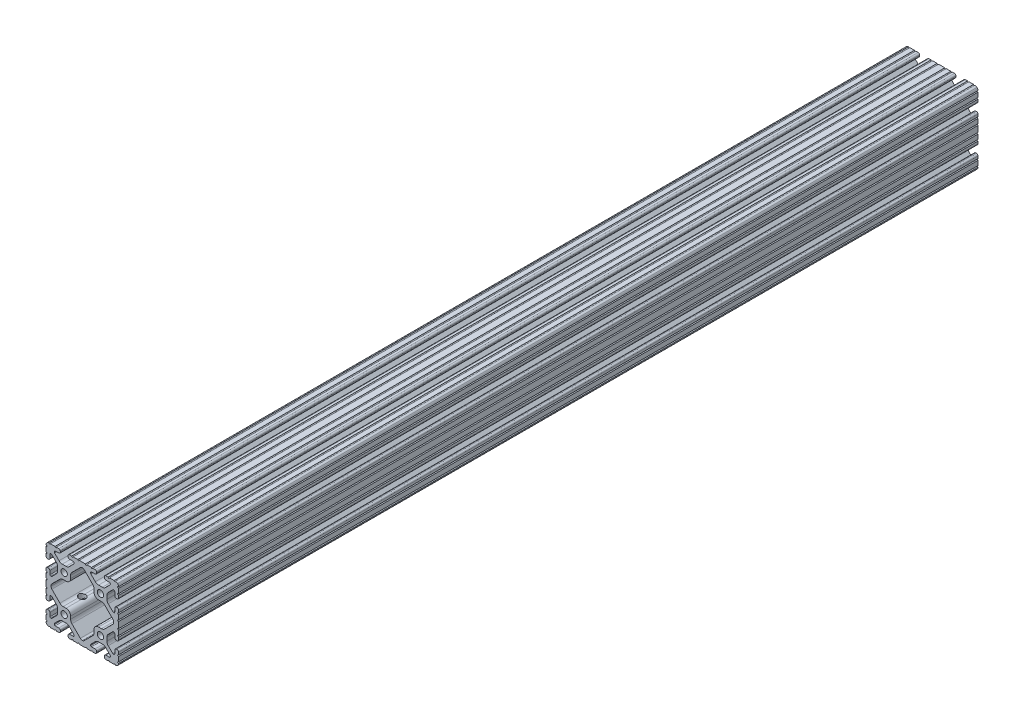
SolidWorks part; units mm, degrees
ref_plane "Front" through (0, 0, 0) normal (0, 0, 1) x (1, 0, 0)
ref_plane "Top" through (0, 0, 0) normal (0, 1, 0) x (1, 0, 0)
ref_plane "Right" through (0, 0, 0) normal (1, 0, 0) x (0, 0, -1)
sketch "Sketch1" plane through (0, 0, 0) normal (0, 0, 1) x (1, 0, 0)
  line L2 (242.4136, 86.674) -> (242.4136, 89.5766)
  line L3 (253.5953, 95.7176) -> (262.0221, 104.1444)
  line L4 (262.0221, 109.0956) -> (253.5953, 117.5224)
  line L5 (250.2367, 118.9136) -> (247.1634, 118.9136)
  line L6 (242.4136, 123.6634) -> (242.4136, 126.566)
  line L7 (241.0224, 129.9246) -> (232.1715, 138.7755)
  line L8 (228.0685, 138.7755) -> (219.2176, 129.9246)
  line L9 (217.8264, 126.566) -> (217.8264, 123.6634)
  line L10 (213.0766, 118.9136) -> (210.0033, 118.9136)
  line L11 (206.6447, 117.5224) -> (198.2179, 109.0956)
  line L12 (198.2179, 104.1444) -> (206.6447, 95.7176)
  line L13 (210.0033, 94.3264) -> (213.0766, 94.3264)
  line L14 (217.8264, 89.5766) -> (217.8264, 86.674)
  line L15 (219.2176, 83.3154) -> (228.0685, 74.4645)
  line L16 (232.1715, 74.4645) -> (241.0224, 83.3154)
  line L17 (247.1634, 94.3264) -> (250.2367, 94.3264)
  line L18 (225.3427, 144.72) -> (220.5147, 144.72)
  line L19 (218.9911, 144.72) -> (216.7088, 144.72)
  line L20 (215.134, 143.1452) -> (215.134, 142.2308)
  line L21 (216.7088, 140.656) -> (220.468, 140.656)
  line L22 (221.357, 139.767) -> (221.357, 139.1135)
  line L23 (221.0966, 138.4849) -> (216.4293, 133.8176)
  line L24 (213.0707, 132.4264) -> (209.0693, 132.4264)
  line L25 (205.7107, 133.8176) -> (201.0198, 138.5085)
  line L26 (200.783, 139.3407) -> (200.783, 139.767)
  line L27 (201.672, 140.656) -> (205.4312, 140.656)
  line L28 (207.006, 142.2308) -> (207.006, 143.1452)
  line L29 (205.4312, 144.72) -> (203.0428, 144.72)
  line L30 (201.5189, 144.72) -> (196.6912, 144.72)
  line L31 (192.02, 139.993) -> (192.02, 135.1653)
  line L32 (192.02, 133.6438) -> (192.02, 131.2502)
  line L33 (193.5948, 129.6754) -> (194.5092, 129.6754)
  line L34 (196.084, 131.2502) -> (196.084, 135.068)
  line L35 (196.973, 135.957) -> (197.4557, 135.957)
  line L36 (198.0843, 135.6966) -> (202.9224, 130.8585)
  line L37 (204.3136, 127.4999) -> (204.3136, 123.8401)
  line L38 (202.9224, 120.4815) -> (198.1711, 115.7301)
  line L39 (197.3331, 115.383) -> (197.0597, 115.383)
  line L40 (196.084, 116.3587) -> (196.084, 120.0898)
  line L41 (194.5092, 121.6646) -> (193.5948, 121.6646)
  line L42 (192.02, 120.0898) -> (192.02, 117.695)
  line L43 (192.02, 116.172) -> (192.02, 111.3438)
  line L44 (192.02, 109.8207) -> (192.02, 103.4193)
  line L45 (192.02, 101.8962) -> (192.02, 97.068)
  line L46 (192.02, 95.545) -> (192.02, 93.1502)
  line L47 (193.5948, 91.5754) -> (194.5092, 91.5754)
  line L48 (196.084, 93.1502) -> (196.084, 96.8813)
  line L49 (197.0597, 97.857) -> (197.3331, 97.857)
  line L50 (198.1711, 97.5099) -> (202.9224, 92.7585)
  line L51 (204.3136, 89.3999) -> (204.3136, 85.7401)
  line L52 (202.9224, 82.3815) -> (198.0843, 77.5434)
  line L53 (197.4557, 77.283) -> (196.973, 77.283)
  line L54 (196.084, 78.172) -> (196.084, 81.9898)
  line L55 (194.5092, 83.5646) -> (193.5948, 83.5646)
  line L56 (192.02, 81.9898) -> (192.02, 79.5962)
  line L57 (192.02, 78.0747) -> (192.02, 73.247)
  line L58 (196.6912, 68.52) -> (201.5189, 68.52)
  line L59 (203.0428, 68.52) -> (205.4312, 68.52)
  line L60 (207.006, 70.0948) -> (207.006, 71.0092)
  line L61 (205.4312, 72.584) -> (201.672, 72.584)
  line L62 (200.783, 73.473) -> (200.783, 73.8993)
  line L63 (201.0198, 74.7315) -> (205.7107, 79.4224)
  line L64 (209.0693, 80.8136) -> (213.0707, 80.8136)
  line L65 (216.4293, 79.4224) -> (221.0966, 74.7551)
  line L66 (221.357, 74.1265) -> (221.357, 73.473)
  line L67 (220.468, 72.584) -> (216.7088, 72.584)
  line L68 (215.134, 71.0092) -> (215.134, 70.0948)
  line L69 (216.7088, 68.52) -> (218.9911, 68.52)
  line L70 (220.5147, 68.52) -> (225.3427, 68.52)
  line L71 (226.8663, 68.52) -> (233.3737, 68.52)
  line L72 (234.8973, 68.52) -> (239.7253, 68.52)
  line L73 (241.2489, 68.52) -> (243.5312, 68.52)
  line L74 (245.106, 70.0948) -> (245.106, 71.0092)
  line L75 (243.5312, 72.584) -> (239.772, 72.584)
  line L76 (238.883, 73.473) -> (238.883, 74.1265)
  line L77 (239.1434, 74.7551) -> (243.8107, 79.4224)
  line L78 (247.1693, 80.8136) -> (251.1707, 80.8136)
  line L79 (254.5293, 79.4224) -> (259.2202, 74.7315)
  line L80 (259.457, 73.8993) -> (259.457, 73.473)
  line L81 (258.568, 72.584) -> (254.8088, 72.584)
  line L82 (253.234, 71.0092) -> (253.234, 70.0948)
  line L83 (254.8088, 68.52) -> (257.1972, 68.52)
  line L84 (258.7211, 68.52) -> (263.5488, 68.52)
  line L85 (268.22, 73.247) -> (268.22, 78.0747)
  line L86 (268.22, 79.5962) -> (268.22, 81.9898)
  line L87 (266.6452, 83.5646) -> (265.7308, 83.5646)
  line L88 (264.156, 81.9898) -> (264.156, 78.172)
  line L89 (263.267, 77.283) -> (262.7843, 77.283)
  line L90 (262.1557, 77.5434) -> (257.3176, 82.3815)
  line L91 (255.9264, 85.7401) -> (255.9264, 89.3999)
  line L92 (257.3176, 92.7585) -> (262.0689, 97.5099)
  line L93 (262.9069, 97.857) -> (263.1803, 97.857)
  line L94 (264.156, 96.8813) -> (264.156, 93.1502)
  line L95 (265.7308, 91.5754) -> (266.6452, 91.5754)
  line L96 (268.22, 93.1502) -> (268.22, 95.545)
  line L97 (268.22, 97.068) -> (268.22, 101.8962)
  line L98 (268.22, 103.4193) -> (268.22, 109.8207)
  line L99 (268.22, 111.3438) -> (268.22, 116.172)
  line L100 (268.22, 117.695) -> (268.22, 120.0898)
  line L101 (266.6452, 121.6646) -> (265.7308, 121.6646)
  line L102 (264.156, 120.0898) -> (264.156, 116.3587)
  line L103 (263.1803, 115.383) -> (262.9069, 115.383)
  line L104 (262.0689, 115.7301) -> (257.3176, 120.4815)
  line L105 (255.9264, 123.8401) -> (255.9264, 127.4999)
  line L106 (257.3176, 130.8585) -> (262.1557, 135.6966)
  line L107 (262.7843, 135.957) -> (263.267, 135.957)
  line L108 (264.156, 135.068) -> (264.156, 131.2502)
  line L109 (265.7308, 129.6754) -> (266.6452, 129.6754)
  line L110 (268.22, 131.2502) -> (268.22, 133.6438)
  line L111 (268.22, 135.1653) -> (268.22, 139.993)
  line L112 (263.5488, 144.72) -> (258.7211, 144.72)
  line L113 (257.1972, 144.72) -> (254.8088, 144.72)
  line L114 (253.234, 143.1452) -> (253.234, 142.2308)
  line L115 (254.8088, 140.656) -> (258.568, 140.656)
  line L116 (259.457, 139.767) -> (259.457, 139.3407)
  line L117 (259.2202, 138.5085) -> (254.5293, 133.8176)
  line L118 (251.1707, 132.4264) -> (247.1693, 132.4264)
  line L119 (243.8107, 133.8176) -> (239.1434, 138.4849)
  line L120 (238.883, 139.1135) -> (238.883, 139.767)
  line L121 (239.772, 140.656) -> (243.5312, 140.656)
  line L122 (245.106, 142.2308) -> (245.106, 143.1452)
  line L123 (243.5312, 144.72) -> (241.2489, 144.72)
  line L124 (239.7253, 144.72) -> (234.8973, 144.72)
  line L125 (233.3737, 144.72) -> (226.8663, 144.72)
  arc A0 (241.0224, 83.3154) -> (242.4136, 86.674) centre (237.6638, 86.674) ccw
  arc A1 (247.1634, 94.3264) -> (242.4136, 89.5766) centre (247.1634, 89.5766) ccw
  arc A2 (250.2367, 94.3264) -> (253.5953, 95.7176) centre (250.2367, 99.0762) ccw
  arc A3 (262.0221, 104.1444) -> (262.8487, 106.62) centre (259.9567, 106.2098) ccw
  arc A4 (262.8487, 106.62) -> (262.0221, 109.0956) centre (259.9567, 107.0302) ccw
  arc A5 (253.5953, 117.5224) -> (250.2367, 118.9136) centre (250.2367, 114.1638) ccw
  arc A6 (242.4136, 123.6634) -> (247.1634, 118.9136) centre (247.1634, 123.6634) ccw
  arc A7 (242.4136, 126.566) -> (241.0224, 129.9246) centre (237.6638, 126.566) ccw
  arc A8 (232.1715, 138.7755) -> (230.12, 139.631) centre (230.1061, 136.71) ccw
  arc A9 (230.12, 139.631) -> (228.0685, 138.7755) centre (230.1339, 136.71) ccw
  arc A10 (219.2176, 129.9246) -> (217.8264, 126.566) centre (222.5762, 126.566) ccw
  arc A11 (213.0766, 118.9136) -> (217.8264, 123.6634) centre (213.0766, 123.6634) ccw
  arc A12 (210.0033, 118.9136) -> (206.6447, 117.5224) centre (210.0033, 114.1638) ccw
  arc A13 (198.2179, 109.0956) -> (197.3913, 106.62) centre (200.2833, 107.0302) ccw
  arc A14 (197.3913, 106.62) -> (198.2179, 104.1444) centre (200.2833, 106.2098) ccw
  arc A15 (206.6447, 95.7176) -> (210.0033, 94.3264) centre (210.0033, 99.0762) ccw
  arc A16 (217.8264, 89.5766) -> (213.0766, 94.3264) centre (213.0766, 89.5766) ccw
  arc A17 (217.8264, 86.674) -> (219.2176, 83.3154) centre (222.5762, 86.674) ccw
  arc A18 (228.0685, 74.4645) -> (230.12, 73.609) centre (230.1339, 76.53) ccw
  arc A19 (230.12, 73.609) -> (232.1715, 74.4645) centre (230.1061, 76.53) ccw
  circle A20 centre (211.07, 125.67) radius 3.3274
  circle A21 centre (211.07, 87.57) radius 3.3274
  circle A22 centre (249.17, 87.57) radius 3.3274
  circle A23 centre (249.17, 125.67) radius 3.3274
  arc A24 (218.9911, 144.72) -> (220.5147, 144.72) centre (219.7529, 144.7024) ccw
  arc A25 (216.7088, 144.72) -> (215.134, 143.1452) centre (216.7088, 143.1452) ccw
  arc A26 (215.134, 142.2308) -> (216.7088, 140.656) centre (216.7088, 142.2308) ccw
  arc A27 (221.357, 139.767) -> (220.468, 140.656) centre (220.468, 139.767) ccw
  arc A28 (221.0966, 138.4849) -> (221.357, 139.1135) centre (220.468, 139.1135) ccw
  arc A29 (213.0707, 132.4264) -> (216.4293, 133.8176) centre (213.0707, 137.1762) ccw
  arc A30 (205.7107, 133.8176) -> (209.0693, 132.4264) centre (209.0693, 137.1762) ccw
  arc A31 (200.783, 139.3407) -> (201.0198, 138.5085) centre (201.6484, 139.1372) ccw
  arc A32 (201.672, 140.656) -> (200.783, 139.767) centre (201.672, 139.767) ccw
  arc A33 (205.4312, 140.656) -> (207.006, 142.2308) centre (205.4312, 142.2308) ccw
  arc A34 (207.006, 143.1452) -> (205.4312, 144.72) centre (205.4312, 143.1452) ccw
  arc A35 (201.5189, 144.72) -> (203.0428, 144.72) centre (202.2808, 144.7024) ccw
  arc A36 (195.1673, 144.72) -> (196.6912, 144.72) centre (195.9293, 144.7024) ccw
  arc A37 (195.1673, 144.72) -> (193.0339, 143.8026) centre (195.2679, 141.5466) ccw
  arc A38 (193.0339, 143.8026) -> (192.02, 141.4655) centre (195.195, 141.4766) ccw
  arc A39 (192.02, 139.993) -> (192.02, 141.4655) centre (192.2165, 140.7292) ccw
  arc A40 (192.02, 133.6438) -> (192.02, 135.1653) centre (192.2165, 134.4045) ccw
  arc A41 (192.02, 131.2502) -> (193.5948, 129.6754) centre (193.5948, 131.2502) ccw
  arc A42 (194.5092, 129.6754) -> (196.084, 131.2502) centre (194.5092, 131.2502) ccw
  arc A43 (196.973, 135.957) -> (196.084, 135.068) centre (196.973, 135.068) ccw
  arc A44 (198.0843, 135.6966) -> (197.4557, 135.957) centre (197.4557, 135.068) ccw
  arc A45 (204.3136, 127.4999) -> (202.9224, 130.8585) centre (199.5638, 127.4999) ccw
  arc A46 (202.9224, 120.4815) -> (204.3136, 123.8401) centre (199.5638, 123.8401) ccw
  arc A47 (197.3331, 115.383) -> (198.1711, 115.7301) centre (197.3331, 116.5681) ccw
  arc A48 (196.084, 116.3587) -> (197.0597, 115.383) centre (197.0597, 116.3587) ccw
  arc A49 (196.084, 120.0898) -> (194.5092, 121.6646) centre (194.5092, 120.0898) ccw
  arc A50 (193.5948, 121.6646) -> (192.02, 120.0898) centre (193.5948, 120.0898) ccw
  arc A51 (192.02, 116.172) -> (192.02, 117.695) centre (192.2165, 116.9335) ccw
  arc A52 (192.02, 109.8207) -> (192.02, 111.3438) centre (192.2165, 110.5822) ccw
  arc A53 (192.02, 101.8962) -> (192.02, 103.4193) centre (192.2165, 102.6578) ccw
  arc A54 (192.02, 95.545) -> (192.02, 97.068) centre (192.2165, 96.3065) ccw
  arc A55 (192.02, 93.1502) -> (193.5948, 91.5754) centre (193.5948, 93.1502) ccw
  arc A56 (194.5092, 91.5754) -> (196.084, 93.1502) centre (194.5092, 93.1502) ccw
  arc A57 (197.0597, 97.857) -> (196.084, 96.8813) centre (197.0597, 96.8813) ccw
  arc A58 (198.1711, 97.5099) -> (197.3331, 97.857) centre (197.3331, 96.6719) ccw
  arc A59 (204.3136, 89.3999) -> (202.9224, 92.7585) centre (199.5638, 89.3999) ccw
  arc A60 (202.9224, 82.3815) -> (204.3136, 85.7401) centre (199.5638, 85.7401) ccw
  arc A61 (197.4557, 77.283) -> (198.0843, 77.5434) centre (197.4557, 78.172) ccw
  arc A62 (196.084, 78.172) -> (196.973, 77.283) centre (196.973, 78.172) ccw
  arc A63 (196.084, 81.9898) -> (194.5092, 83.5646) centre (194.5092, 81.9898) ccw
  arc A64 (193.5948, 83.5646) -> (192.02, 81.9898) centre (193.5948, 81.9898) ccw
  arc A65 (192.02, 78.0747) -> (192.02, 79.5962) centre (192.2165, 78.8355) ccw
  arc A66 (192.02, 71.7745) -> (192.02, 73.247) centre (192.2165, 72.5108) ccw
  arc A67 (192.02, 71.7745) -> (193.0339, 69.4374) centre (195.195, 71.7634) ccw
  arc A68 (193.0339, 69.4374) -> (195.1673, 68.52) centre (195.2679, 71.6934) ccw
  arc A69 (196.6912, 68.52) -> (195.1673, 68.52) centre (195.9293, 68.5376) ccw
  arc A70 (203.0428, 68.52) -> (201.5189, 68.52) centre (202.2808, 68.5376) ccw
  arc A71 (205.4312, 68.52) -> (207.006, 70.0948) centre (205.4312, 70.0948) ccw
  arc A72 (207.006, 71.0092) -> (205.4312, 72.584) centre (205.4312, 71.0092) ccw
  arc A73 (200.783, 73.473) -> (201.672, 72.584) centre (201.672, 73.473) ccw
  arc A74 (201.0198, 74.7315) -> (200.783, 73.8993) centre (201.6484, 74.1028) ccw
  arc A75 (209.0693, 80.8136) -> (205.7107, 79.4224) centre (209.0693, 76.0638) ccw
  arc A76 (216.4293, 79.4224) -> (213.0707, 80.8136) centre (213.0707, 76.0638) ccw
  arc A77 (221.357, 74.1265) -> (221.0966, 74.7551) centre (220.468, 74.1265) ccw
  arc A78 (220.468, 72.584) -> (221.357, 73.473) centre (220.468, 73.473) ccw
  arc A79 (216.7088, 72.584) -> (215.134, 71.0092) centre (216.7088, 71.0092) ccw
  arc A80 (215.134, 70.0948) -> (216.7088, 68.52) centre (216.7088, 70.0948) ccw
  arc A81 (220.5147, 68.52) -> (218.9911, 68.52) centre (219.7529, 68.5376) ccw
  arc A82 (226.8663, 68.52) -> (225.3427, 68.52) centre (226.1045, 68.5376) ccw
  arc A83 (234.8973, 68.52) -> (233.3737, 68.52) centre (234.1355, 68.5376) ccw
  arc A84 (241.2489, 68.52) -> (239.7253, 68.52) centre (240.4871, 68.5376) ccw
  arc A85 (243.5312, 68.52) -> (245.106, 70.0948) centre (243.5312, 70.0948) ccw
  arc A86 (245.106, 71.0092) -> (243.5312, 72.584) centre (243.5312, 71.0092) ccw
  arc A87 (238.883, 73.473) -> (239.772, 72.584) centre (239.772, 73.473) ccw
  arc A88 (239.1434, 74.7551) -> (238.883, 74.1265) centre (239.772, 74.1265) ccw
  arc A89 (247.1693, 80.8136) -> (243.8107, 79.4224) centre (247.1693, 76.0638) ccw
  arc A90 (254.5293, 79.4224) -> (251.1707, 80.8136) centre (251.1707, 76.0638) ccw
  arc A91 (259.457, 73.8993) -> (259.2202, 74.7315) centre (258.5916, 74.1028) ccw
  arc A92 (258.568, 72.584) -> (259.457, 73.473) centre (258.568, 73.473) ccw
  arc A93 (254.8088, 72.584) -> (253.234, 71.0092) centre (254.8088, 71.0092) ccw
  arc A94 (253.234, 70.0948) -> (254.8088, 68.52) centre (254.8088, 70.0948) ccw
  arc A95 (258.7211, 68.52) -> (257.1972, 68.52) centre (257.9592, 68.5376) ccw
  arc A96 (265.0727, 68.52) -> (263.5488, 68.52) centre (264.3107, 68.5376) ccw
  arc A97 (265.0727, 68.52) -> (267.2061, 69.4374) centre (264.9721, 71.6934) ccw
  arc A98 (267.2061, 69.4374) -> (268.22, 71.7745) centre (265.045, 71.7634) ccw
  arc A99 (268.22, 73.247) -> (268.22, 71.7745) centre (268.0235, 72.5108) ccw
  arc A100 (268.22, 79.5962) -> (268.22, 78.0747) centre (268.0235, 78.8355) ccw
  arc A101 (268.22, 81.9898) -> (266.6452, 83.5646) centre (266.6452, 81.9898) ccw
  arc A102 (265.7308, 83.5646) -> (264.156, 81.9898) centre (265.7308, 81.9898) ccw
  arc A103 (263.267, 77.283) -> (264.156, 78.172) centre (263.267, 78.172) ccw
  arc A104 (262.1557, 77.5434) -> (262.7843, 77.283) centre (262.7843, 78.172) ccw
  arc A105 (255.9264, 85.7401) -> (257.3176, 82.3815) centre (260.6762, 85.7401) ccw
  arc A106 (257.3176, 92.7585) -> (255.9264, 89.3999) centre (260.6762, 89.3999) ccw
  arc A107 (262.9069, 97.857) -> (262.0689, 97.5099) centre (262.9069, 96.6719) ccw
  arc A108 (264.156, 96.8813) -> (263.1803, 97.857) centre (263.1803, 96.8813) ccw
  arc A109 (264.156, 93.1502) -> (265.7308, 91.5754) centre (265.7308, 93.1502) ccw
  arc A110 (266.6452, 91.5754) -> (268.22, 93.1502) centre (266.6452, 93.1502) ccw
  arc A111 (268.22, 97.068) -> (268.22, 95.545) centre (268.0235, 96.3065) ccw
  arc A112 (268.22, 103.4193) -> (268.22, 101.8962) centre (268.0235, 102.6578) ccw
  arc A113 (268.22, 111.3438) -> (268.22, 109.8207) centre (268.0235, 110.5822) ccw
  arc A114 (268.22, 117.695) -> (268.22, 116.172) centre (268.0235, 116.9335) ccw
  arc A115 (268.22, 120.0898) -> (266.6452, 121.6646) centre (266.6452, 120.0898) ccw
  arc A116 (265.7308, 121.6646) -> (264.156, 120.0898) centre (265.7308, 120.0898) ccw
  arc A117 (263.1803, 115.383) -> (264.156, 116.3587) centre (263.1803, 116.3587) ccw
  arc A118 (262.0689, 115.7301) -> (262.9069, 115.383) centre (262.9069, 116.5681) ccw
  arc A119 (255.9264, 123.8401) -> (257.3176, 120.4815) centre (260.6762, 123.8401) ccw
  arc A120 (257.3176, 130.8585) -> (255.9264, 127.4999) centre (260.6762, 127.4999) ccw
  arc A121 (262.7843, 135.957) -> (262.1557, 135.6966) centre (262.7843, 135.068) ccw
  arc A122 (264.156, 135.068) -> (263.267, 135.957) centre (263.267, 135.068) ccw
  arc A123 (264.156, 131.2502) -> (265.7308, 129.6754) centre (265.7308, 131.2502) ccw
  arc A124 (266.6452, 129.6754) -> (268.22, 131.2502) centre (266.6452, 131.2502) ccw
  arc A125 (268.22, 135.1653) -> (268.22, 133.6438) centre (268.0235, 134.4045) ccw
  arc A126 (268.22, 141.4655) -> (268.22, 139.993) centre (268.0235, 140.7292) ccw
  arc A127 (268.22, 141.4655) -> (267.2061, 143.8026) centre (265.045, 141.4766) ccw
  arc A128 (267.2061, 143.8026) -> (265.0727, 144.72) centre (264.9721, 141.5466) ccw
  arc A129 (263.5488, 144.72) -> (265.0727, 144.72) centre (264.3107, 144.7024) ccw
  arc A130 (257.1972, 144.72) -> (258.7211, 144.72) centre (257.9592, 144.7024) ccw
  arc A131 (254.8088, 144.72) -> (253.234, 143.1452) centre (254.8088, 143.1452) ccw
  arc A132 (253.234, 142.2308) -> (254.8088, 140.656) centre (254.8088, 142.2308) ccw
  arc A133 (259.457, 139.767) -> (258.568, 140.656) centre (258.568, 139.767) ccw
  arc A134 (259.2202, 138.5085) -> (259.457, 139.3407) centre (258.5916, 139.1372) ccw
  arc A135 (251.1707, 132.4264) -> (254.5293, 133.8176) centre (251.1707, 137.1762) ccw
  arc A136 (243.8107, 133.8176) -> (247.1693, 132.4264) centre (247.1693, 137.1762) ccw
  arc A137 (238.883, 139.1135) -> (239.1434, 138.4849) centre (239.772, 139.1135) ccw
  arc A138 (239.772, 140.656) -> (238.883, 139.767) centre (239.772, 139.767) ccw
  arc A139 (243.5312, 140.656) -> (245.106, 142.2308) centre (243.5312, 142.2308) ccw
  arc A140 (245.106, 143.1452) -> (243.5312, 144.72) centre (243.5312, 143.1452) ccw
  arc A141 (239.7253, 144.72) -> (241.2489, 144.72) centre (240.4871, 144.7024) ccw
  arc A142 (233.3737, 144.72) -> (234.8973, 144.72) centre (234.1355, 144.7024) ccw
  arc A143 (225.3427, 144.72) -> (226.8663, 144.72) centre (226.1045, 144.7024) ccw
extrude "Extrude2" add sketch "Sketch1" along normal blind 901.7
sketch "Sketch2" plane through (123.5, 144.72, 0) normal (0, -1, 0) x (0, 0, -1)
  line L0 (-901.7, 78.0189) -> (-901.7, 73.1912) construction
  line L4 (-901.7, 144.72) -> (0, 144.72) construction
  line L5 (-901.7, 140.0488) -> (-901.7, 135.2211) construction
  line L6 (-901.7, 127.6707) -> (-901.7, 123.6693) construction
  circle A0 centre (-882.65, 125.67) radius 3.5719
  circle A1 centre (-82.55, 125.67) radius 3.5719
  circle A2 centre (-882.65, 87.57) radius 3.5719
  circle A3 centre (-82.55, 87.57) radius 3.5719
  dimension "D1" = 7.1437
  dimension "D2" = 7.1437
  dimension "D3" = 7.1437
  dimension "D4" = 7.1437
  dimension "D5" = 19.05
  dimension "D6" = 38.1
  dimension "D7" = 38.1
  dimension "D8" = 19.05
  dimension "D9" = 19.05
  dimension "D10" = 819.15
  dimension "D11" = 19.05
  dimension "D12" = 819.15
extrude "Extrude8" cut sketch "Sketch2" along normal blind 76.2
